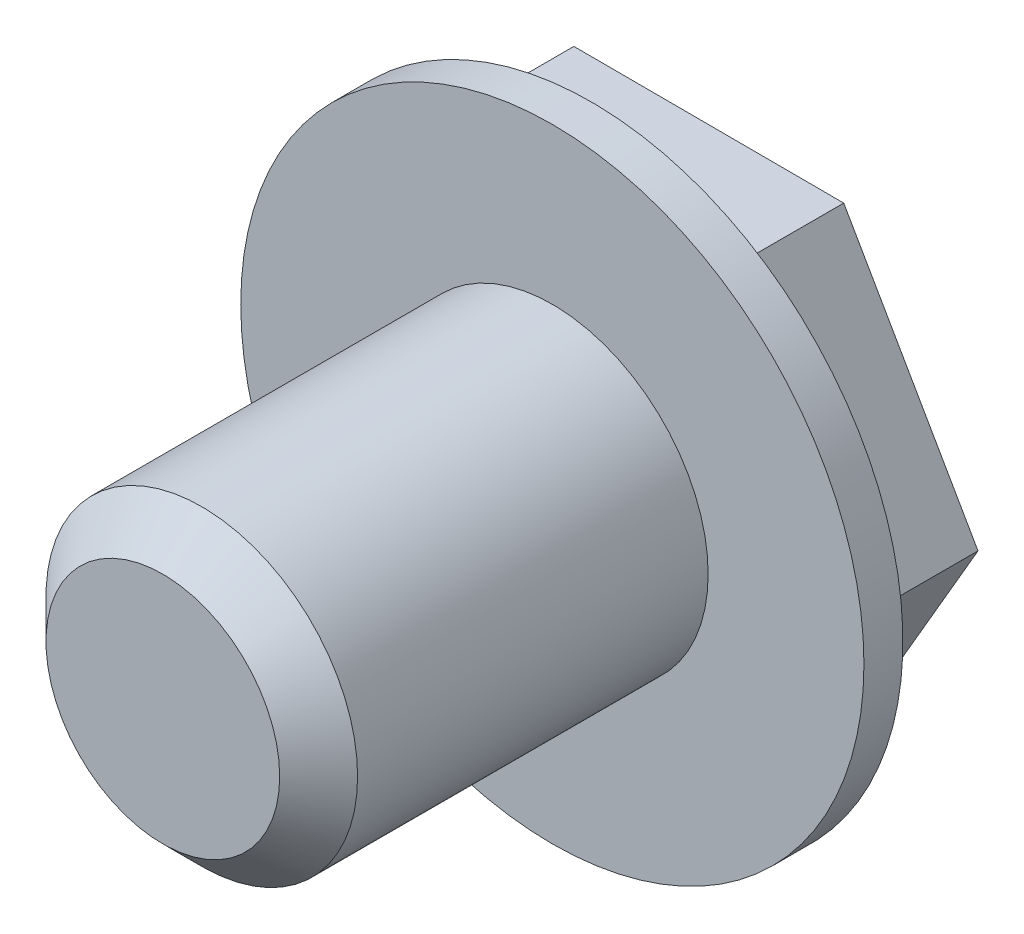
SolidWorks part; units mm, degrees
ref_plane "Plan de face" through (0, 0, 0) normal (0, 0, 1) x (1, 0, 0)
ref_plane "Plan de dessus" through (0, 0, 0) normal (0, 1, 0) x (1, 0, 0)
ref_plane "Plan de droite" through (0, 0, 0) normal (1, 0, 0) x (0, 0, -1)
sketch "Esquisse1" plane through (0, 0, 0) normal (0, 0, 1) x (1, 0, 0)
  circle A0 centre (0, 0) radius 4
  dimension "D1" = 8
extrude "Boss.-Extru.1" add sketch "Esquisse1" along normal blind 7
sketch "Esquisse2" plane through (0, 0, 7) normal (0, 0, 1) x (1, 0, 0)
  circle A0 centre (0, 0) radius 2
  dimension "D1" = 4
extrude "Enlèv. mat.-Extru.1" cut sketch "Esquisse2" against normal blind 5 flip side to cut
chamfer "Chanfrein1" distance 0.5 angle 45 1 edges at (2, 0, 7)
sketch "Esquisse3" plane through (0, 0, 0) normal (0, 0, -1) x (-1, 0, 0)
  line L0 (-4.51, 0) -> (5.1009, 0) construction
  line L2 (1.7407, -2.995) -> (3.4641, 0.01)
  line L3 (3.4641, 0.01) -> (1.7234, 3.005)
  line L4 (1.7234, 3.005) -> (-1.7407, 2.995)
  line L5 (-1.7407, 2.995) -> (-3.4641, -0.01)
  line L6 (-3.4641, -0.01) -> (-1.7234, -3.005)
  line L7 (-1.7234, -3.005) -> (1.7407, -2.995)
  circle A0 centre (0, 0) radius 3 construction
  dimension "D1" = 6
  dimension "D2" = 3.4641
extrude "Enlèv. mat.-Extru.2" cut sketch "Esquisse3" against normal blind 1.5 flip side to cut
sketch "Esquisse4" plane through (0, 0, 0) normal (0, 0, -1) x (-1, 0, 0)
  line L0 (-4.5826, 0) -> (4.4996, 0) construction
  line L1 (0, 4.2145) -> (0, -4.4841) construction
  line L3 (-0.5, 2) -> (0.5, 2)
  line L4 (-0.5, 2) -> (-0.5, -2)
  line L5 (-0.5, -2) -> (0.5, -2)
  line L6 (0.5, 2) -> (0.5, -2)
  line L7 (-2, 0.5) -> (2, 0.5)
  line L8 (-2, 0.5) -> (-2, -0.5)
  line L9 (-2, -0.5) -> (2, -0.5)
  line L10 (2, 0.5) -> (2, -0.5)
  dimension "D1" = 2
  dimension "D2" = 4
  dimension "D3" = 0.5
  dimension "D4" = 4
  dimension "D5" = 1
  dimension "D6" = 1
  dimension "D7" = 0.5
  dimension "D8" = 2
extrude "Enlèv. mat.-Extru.3" cut sketch "Esquisse4" against normal blind 1 contours L4 L5 L6 L3 | L7 L10 L9 L8
